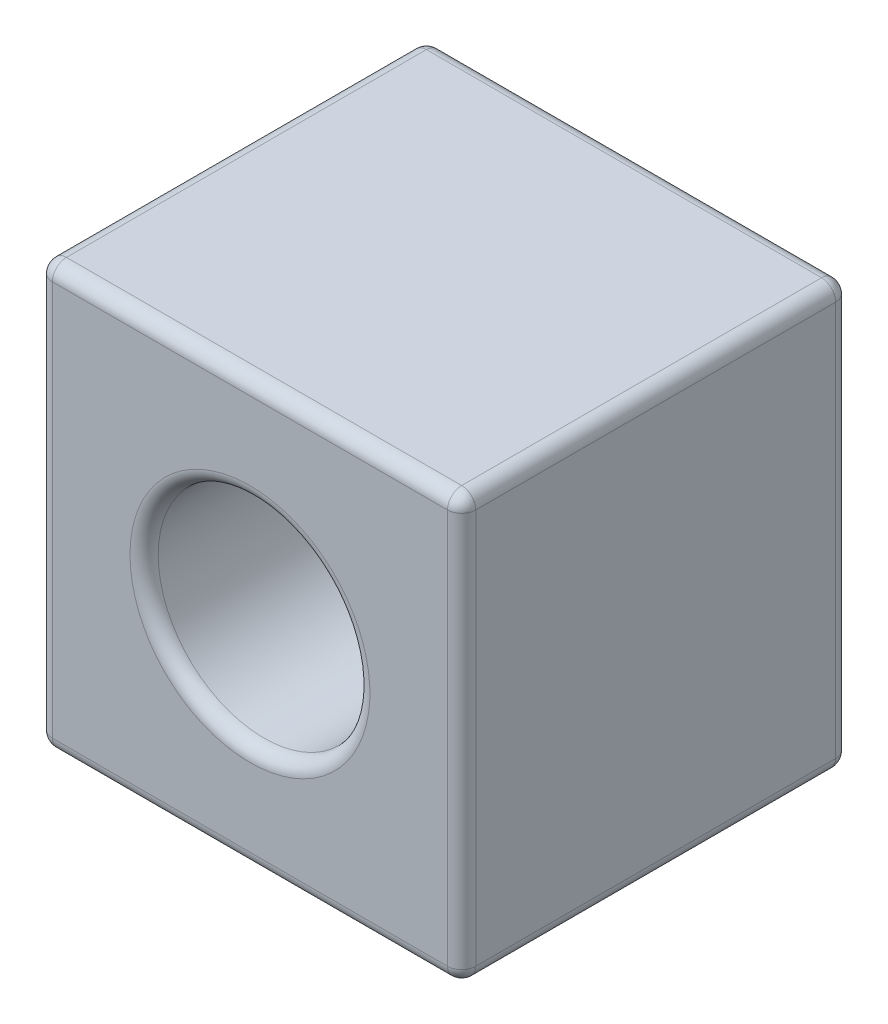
SolidWorks part; units mm, degrees
ref_plane "Face" through (0, 0, 0) normal (0, 0, 1) x (1, 0, 0)
ref_plane "Dessus" through (0, 0, 0) normal (0, 1, 0) x (1, 0, 0)
ref_plane "Droite" through (0, 0, 0) normal (1, 0, 0) x (0, 0, -1)
sketch "Esquisse1" plane through (0, 0, 0) normal (0, 0, 1) x (1, 0, 0)
  line L1 (-2.8, 3) -> (2.8, 3)
  line L2 (-3, 2.8) -> (-3, -2.8)
  line L3 (-2.8, -3) -> (2.8, -3)
  line L4 (3, 2.8) -> (3, -2.8)
  circle A0 centre (0, 0) radius 1.5
  arc A1 (-3, 2.8) -> (-2.8, 3) centre (-2.8, 2.8) cw
  arc A2 (-2.8, -3) -> (-3, -2.8) centre (-2.8, -2.8) cw
  arc A3 (3, -2.8) -> (2.8, -3) centre (2.8, -2.8) cw
  arc A4 (3, 2.8) -> (2.8, 3) centre (2.8, 2.8) ccw
  point P8 (-3, 3)
  point P11 (-3, -3)
  point P14 (3, -3)
  dimension "D5" = 3
  dimension "D6" = 0.2
  dimension "D1" = 3
  dimension "D2" = 6
  dimension "D3" = 3
  dimension "D4" = 6
extrude "Extrusion1" add sketch "Esquisse1" along normal blind 5.5
fillet "Congé1" radius 0.2
